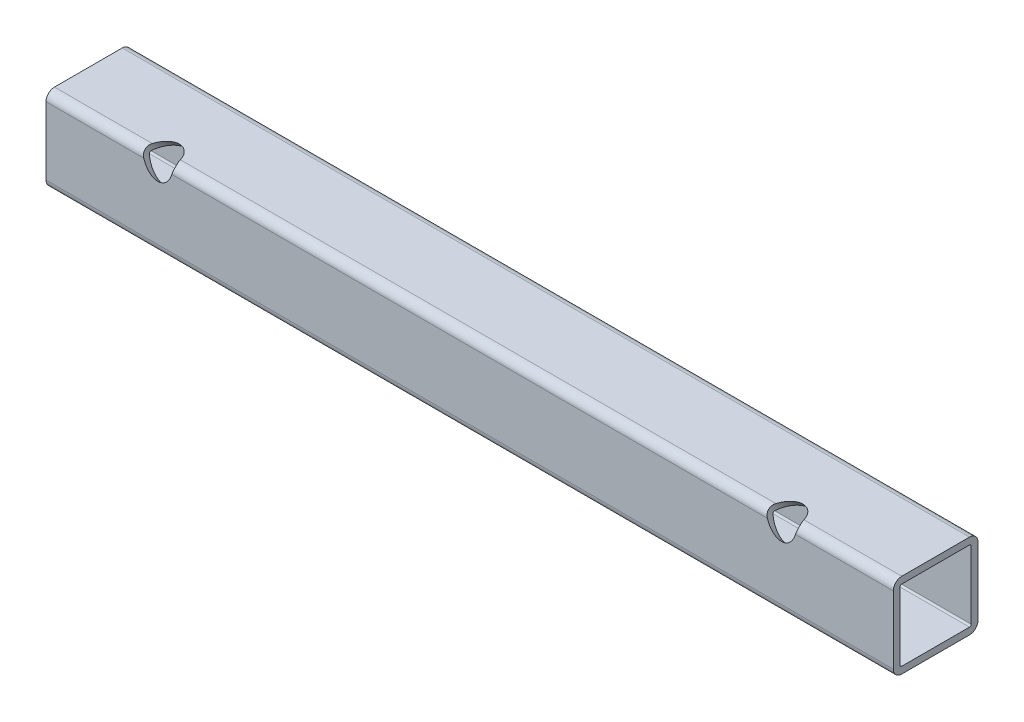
SolidWorks part; units mm, degrees
ref_plane "Plan de face" through (0, 0, 0) normal (0, 0, 1) x (1, 0, 0)
ref_plane "Plan de dessus" through (0, 0, 0) normal (0, 1, 0) x (1, 0, 0)
ref_plane "Plan de droite" through (0, 0, 0) normal (1, 0, 0) x (0, 0, -1)
sketch "Esquisse1" plane through (0, 0, 0) normal (1, 0, 0) x (0, 0, -1)
  line L0 (-10, 10.5) -> (10, 10.5)
  line L1 (-10, 12.5) -> (10, 12.5)
  line L2 (-12.5, 10) -> (-12.5, -10)
  line L3 (-10, -12.5) -> (10, -12.5)
  line L4 (12.5, 10) -> (12.5, -10)
  line L5 (-12.5, 12.5) -> (12.5, -12.5) construction
  line L6 (-12.5, -12.5) -> (12.5, 12.5) construction
  line L7 (10.5, 10) -> (10.5, -10)
  line L8 (-10, -10.5) -> (10, -10.5)
  line L9 (-10.5, 10) -> (-10.5, -10)
  arc A0 (-12.5, -10) -> (-10, -12.5) centre (-10, -10) ccw
  arc A1 (10, -12.5) -> (12.5, -10) centre (10, -10) ccw
  arc A2 (10, 12.5) -> (12.5, 10) centre (10, 10) cw
  arc A3 (-10, 12.5) -> (-12.5, 10) centre (-10, 10) ccw
  arc A4 (10, 10.5) -> (10.5, 10) centre (10, 10) cw
  arc A5 (10, -10.5) -> (10.5, -10) centre (10, -10) ccw
  arc A6 (-10.5, -10) -> (-10, -10.5) centre (-10, -10) ccw
  arc A7 (-10, 10.5) -> (-10.5, 10) centre (-10, 10) ccw
  point P0 (0, 0)
  dimension "D2" = 2.5
  dimension "D1" = 25
  dimension "D3" = 2
extrude "Boss.-Extru.1" add sketch "Esquisse1" along normal mid plane 250
ref_plane "Plan1" through (0, 11.7678, 11.7678) normal (0, 0.7071, 0.7071) x (-1, 0, 0)
sketch "Esquisse3" plane through (0, 11.7678, 11.7678) normal (0, 0.7071, 0.7071) x (-1, 0, 0)
  line L0 (0, 24.2571) -> (0, -31.6168) construction
  circle A0 centre (-92, 0) radius 4.5
  circle A1 centre (92, 0) radius 4.5
  dimension "D1" = 9
  dimension "D2" = 184
extrude "Enlèv. mat.-Extru.1" cut sketch "Esquisse3" against normal up to next
